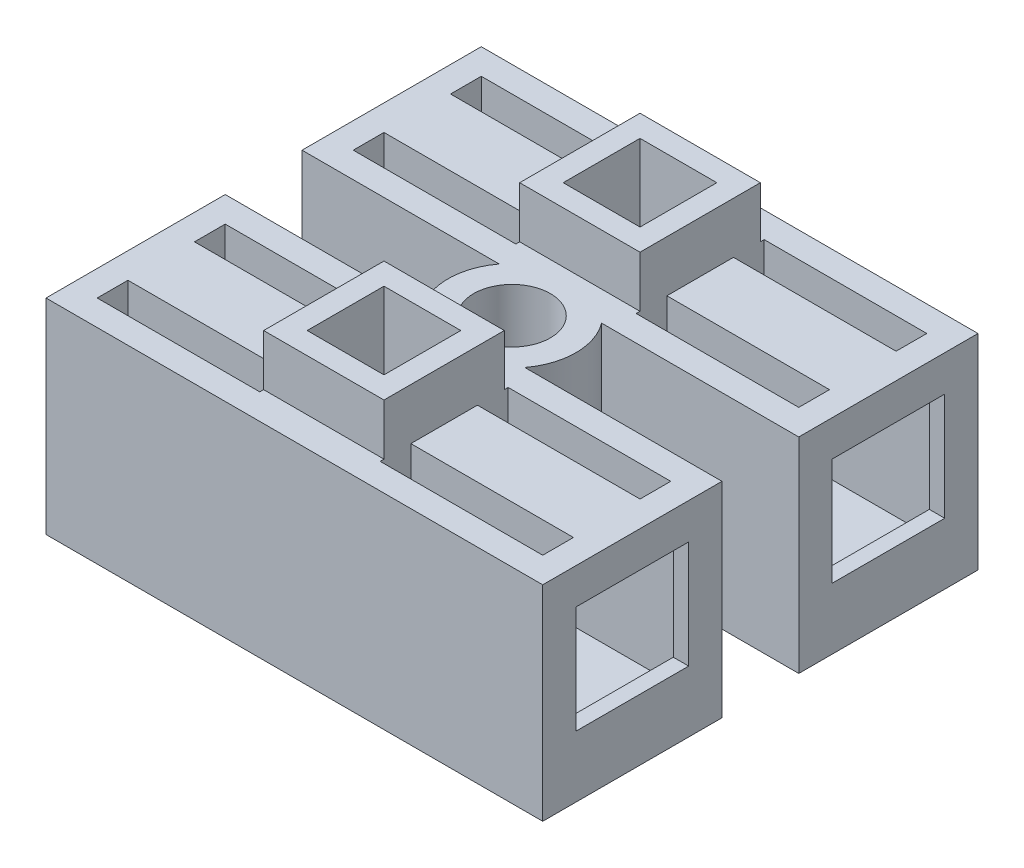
SolidWorks part; units mm, degrees
ref_plane "Front Plane" through (0, 0, 0) normal (0, 0, 1) x (1, 0, 0)
ref_plane "Top Plane" through (0, 0, 0) normal (0, 1, 0) x (1, 0, 0)
ref_plane "Right Plane" through (0, 0, 0) normal (1, 0, 0) x (0, 0, -1)
sketch "Sketch1" plane through (0, 0, 0) normal (0, 1, 0) x (1, 0, 0)
  line L0 (0, 0) -> (0, 1.5) construction
  line L1 (-9.7, 8.5) -> (9.7, 8.5)
  line L2 (-9.7, 8.5) -> (-9.7, 1.5)
  line L3 (-9.7, 1.5) -> (9.7, 1.5)
  line L4 (9.7, 8.5) -> (9.7, 1.5)
  line L5 (-9.7, 8.5) -> (9.7, 1.5) construction
  line L6 (-9.7, 1.5) -> (9.7, 8.5) construction
  point P0 (0, 5)
  dimension "D1" = 19.4
  dimension "D2" = 7
  dimension "D3" = 1.5
extrude "Boss-Extrude1" add sketch "Sketch1" along normal mid plane 8
sketch "Sketch3" plane through (0, 0, 0) normal (1, 0, 0) x (0, 0, -1)
  line L0 (8.5, 4) -> (1.5, -4) construction
  line L1 (2.5, 2.8) -> (7.5, 2.8)
  line L2 (2.5, 2.8) -> (2.5, -2.8)
  line L3 (2.5, -2.8) -> (7.5, -2.8)
  line L4 (7.5, 2.8) -> (7.5, -2.8)
  line L5 (2.5, 2.8) -> (7.5, -2.8) construction
  line L6 (2.5, -2.8) -> (7.5, 2.8) construction
  line L7 (8.5, 4) -> (1.5, 4) construction
  line L8 (8.5, 4) -> (8.5, -4) construction
  point P0 (5, 0)
  dimension "D1" = 1.2
  dimension "D2" = 1
extrude "METAL BODY PLACEMENT" cut sketch "Sketch3" against normal through all both and the other way through all
ref_plane "MIRROR SLOT PLANE" through (0, 0, -5) normal (0, 0, 1) x (1, 0, 0)
sketch "Sketch9" plane through (0, 4, 0) normal (0, 1, 0) x (1, 0, 0)
  line L0 (-9.7, 1.5) -> (9.7, 8.5) construction
  line L1 (2.35, 7.35) -> (-2.35, 7.35)
  line L2 (2.35, 7.35) -> (2.35, 2.65)
  line L3 (2.35, 2.65) -> (-2.35, 2.65)
  line L4 (-2.35, 7.35) -> (-2.35, 2.65)
  line L5 (2.35, 7.35) -> (-2.35, 2.65) construction
  line L6 (2.35, 2.65) -> (-2.35, 7.35) construction
  point P0 (0, 5)
  dimension "D1" = 4.7
  dimension "D2" = 4.7
extrude "Boss-Extrude6" add sketch "Sketch9" along normal blind 2
sketch "Sketch10" plane through (0, 6, 0) normal (0, 1, 0) x (1, 0, 0)
  line L0 (-1.5, 6.5) -> (-1.5, 3.5)
  line L1 (-1.5, 3.5) -> (1.5, 3.5)
  line L2 (1.5, 3.5) -> (1.5, 6.5)
  line L3 (1.5, 6.5) -> (-1.5, 6.5)
  line L4 (-2.35, 7.35) -> (-2.35, 2.65)
  line L5 (-2.35, 2.65) -> (2.35, 2.65)
  line L6 (2.35, 2.65) -> (2.35, 7.35)
  line L7 (2.35, 7.35) -> (-2.35, 7.35)
  line L8 (-2.35, 7.35) -> (-2.35, 2.65) construction
  line L9 (-2.35, 2.65) -> (2.35, 2.65) construction
  line L10 (2.35, 2.65) -> (2.35, 7.35) construction
  line L11 (2.35, 7.35) -> (-2.35, 7.35) construction
  dimension "D3" = 3
  dimension "D4" = 3
  dimension "D1" = 0
  dimension "D2" = 0.85
extrude "Cut-Extrude6" cut sketch "Sketch10" against normal up to next
sketch "Sketch4" plane through (0, 4, 0) normal (0, 1, 0) x (1, 0, 0)
  line L0 (-9.7, 7.5) -> (9.7, 7.5) construction
  line L1 (-2.35, 6.3) -> (-8.7, 6.3)
  line L2 (-2.35, 6.3) -> (-2.35, 7.5)
  line L3 (-2.35, 7.5) -> (-8.7, 7.5)
  line L4 (-8.7, 6.3) -> (-8.7, 7.5)
  line L5 (-9.7, 8.5) -> (-9.7, 1.5) construction
  line L6 (-2.35, 7.35) -> (-2.35, 2.65) construction
  dimension "D2" = 1.2
  dimension "D3" = 1
extrude "Cut-Extrude7" cut sketch "Sketch4" against normal up to next
mirror "Mirror8" about plane through (0, 0, -5) normal (0, 0, 1) of "Cut-Extrude7"
mirror "Mirror9" about plane through (0, 0, 0) normal (1, 0, 0) of "Mirror8", "Cut-Extrude7"
sketch "Sketch2" plane through (9.7, 0, 0) normal (1, 0, 0) x (0, 0, -1)
  line L0 (5, 0.5) -> (5, 4) construction
  line L1 (2.8, 2.6) -> (7.2, 2.6)
  line L2 (2.8, 2.6) -> (2.8, -1.6)
  line L3 (2.8, -1.6) -> (7.2, -1.6)
  line L4 (7.2, 2.6) -> (7.2, -1.6)
  line L5 (2.8, 2.6) -> (7.2, -1.6) construction
  line L6 (1.5, -4) -> (8.5, -4) construction
  line L7 (1.5, 4) -> (8.5, 4) construction
  line L8 (8.5, 4) -> (8.5, -4) construction
  line L14 (1.5, -4) -> (8.5, -4)
  line L15 (8.5, -4) -> (8.5, 4)
  line L16 (8.5, 4) -> (1.5, 4)
  line L17 (1.5, 4) -> (1.5, -4)
  line L18 (1.5, -4) -> (8.5, -4)
  line L19 (8.5, -4) -> (8.5, 4)
  line L20 (8.5, 4) -> (1.5, 4)
  line L21 (1.5, 4) -> (1.5, -4)
  point P0 (5, 0.5)
  dimension "D1" = 1.4
  dimension "D2" = 1.3
  dimension "D3" = 2.4
  dimension "D4" = 0
extrude "Boss-Extrude2" add sketch "Sketch2" against normal blind 0.6
sketch "Sketch7" plane through (0, -4, 0) normal (0, -1, 0) x (1, 0, 0)
  line L0 (8.7, -7.5) -> (8.7, -2.5)
  line L1 (8.7, -2.5) -> (-8.7, -2.5)
  line L2 (-8.7, -2.5) -> (-8.7, -7.5)
  line L3 (-8.7, -7.5) -> (8.7, -7.5)
  line L4 (9.7, -8.5) -> (9.7, -1.5)
  line L5 (9.7, -1.5) -> (-9.7, -1.5)
  line L6 (-9.7, -1.5) -> (-9.7, -8.5)
  line L7 (-9.7, -8.5) -> (9.7, -8.5)
  line L8 (9.7, -8.5) -> (9.7, -1.5) construction
  line L9 (9.7, -1.5) -> (-9.7, -1.5) construction
  line L10 (-9.7, -1.5) -> (-9.7, -8.5) construction
  line L11 (-9.7, -8.5) -> (9.7, -8.5) construction
  dimension "D1" = 0
  dimension "D2" = 1
extrude "Cut-Extrude5" cut sketch "Sketch7" against normal blind 0.4
sketch "Sketch8" plane through (0, 0, 0) normal (0, 1, 0) x (1, 0, 0)
  circle A0 centre (0, 0) radius 1.5
  circle A1 centre (0, 0) radius 2.5
  dimension "D1" = 3
  dimension "D2" = 5
extrude "Boss-Extrude5" add sketch "Sketch8" along normal up to surface and the other way up to surface
mirror "Mirror7" about plane through (0, 0, 0) normal (0, 0, 1) of "Mirror9", "Mirror8", "Cut-Extrude6", "Boss-Extrude6", "Cut-Extrude5", "Boss-Extrude2", "METAL BODY PLACEMENT", "Boss-Extrude1", "Cut-Extrude7"
